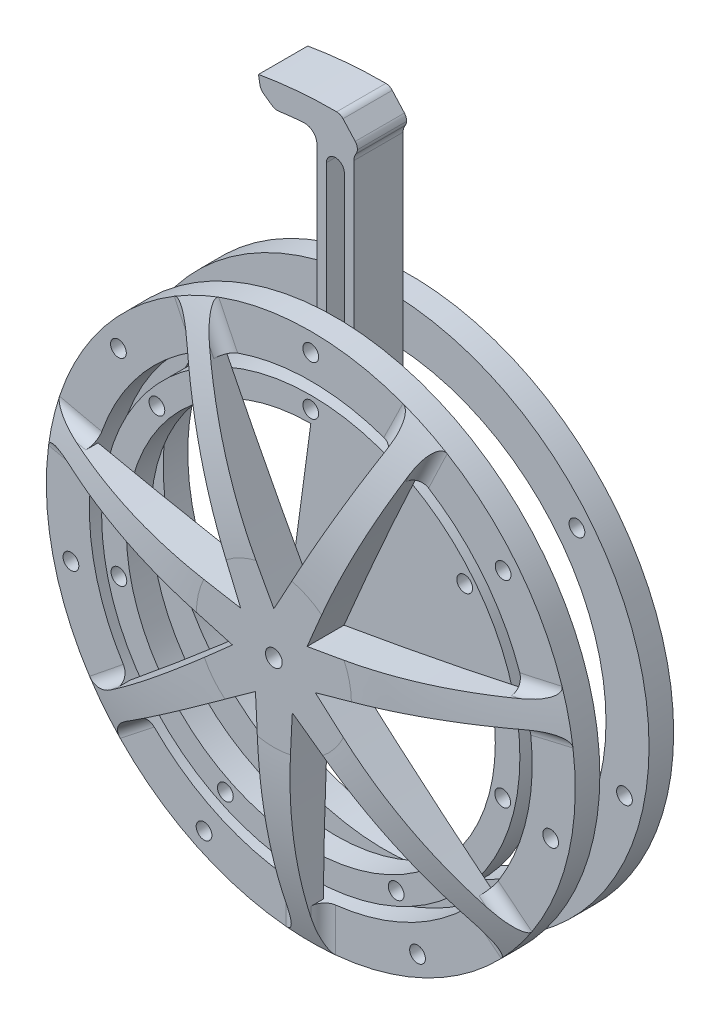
SolidWorks part; units mm, degrees
other "<tooth>-<Fillet3>"
other "<tooth>-<Boss-Extrude1[1]>"
other "<tooth>-<LPattern1>"
other "<tooth>-<Fillet1>"
ref_plane "Front Plane" through (0, 0, 0) normal (0, 0, 1) x (1, 0, 0)
ref_plane "Top Plane" through (0, 0, 0) normal (0, 1, 0) x (1, 0, 0)
ref_plane "Right Plane" through (0, 0, 0) normal (1, 0, 0) x (0, 0, -1)
mirrored part "tooth_Mirrored"
